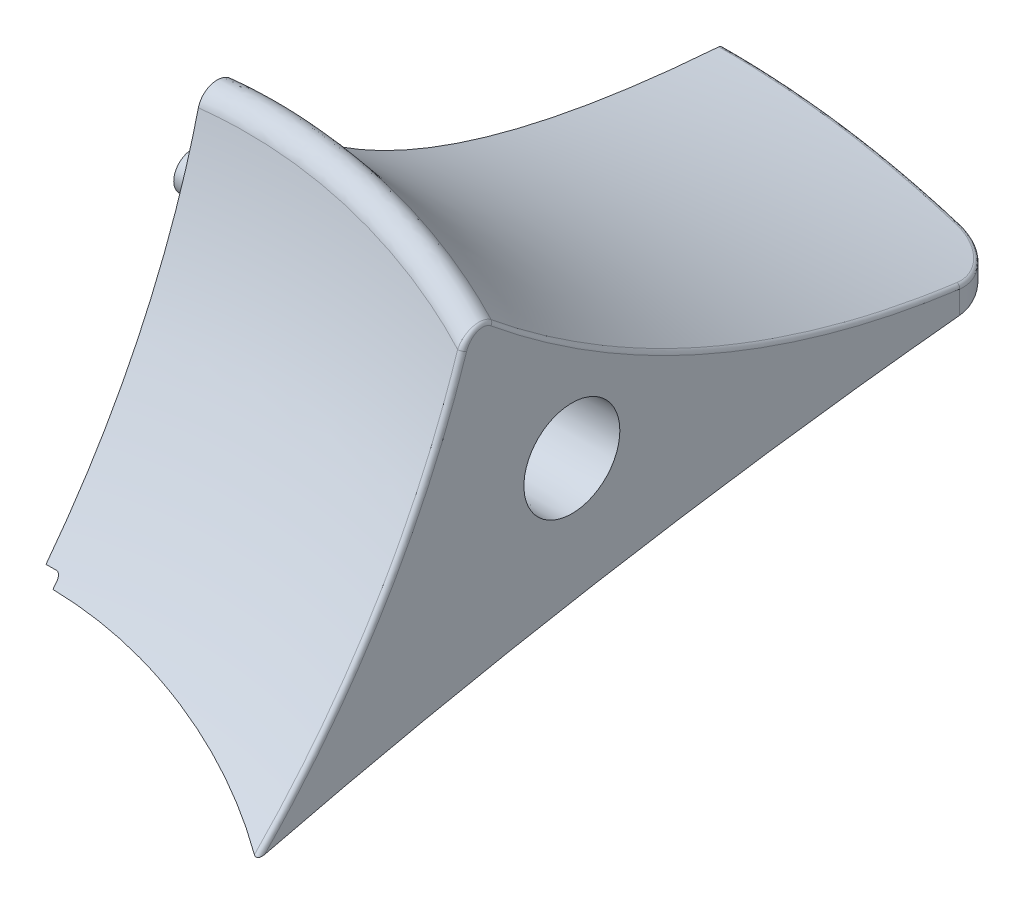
SolidWorks part; units mm, degrees
ref_plane "Ebene vorne" through (0, 0, 0) normal (0, 0, 1) x (1, 0, 0)
ref_plane "Ebene oben" through (0, 0, 0) normal (0, 1, 0) x (1, 0, 0)
ref_plane "Ebene rechts" through (0, 0, 0) normal (1, 0, 0) x (0, 0, -1)
imported_body "Importiert1"
surface "Surface-Offset1" parameters "D1"=0
surface "Surface-Fill1"
surface "Surface-Fill2"
surface "Surface-Fill3"
surface "Surface-Fill4"
surface "Surface-Fill5"
surface "Surface-Knit1"
other "DeleteFace8"
